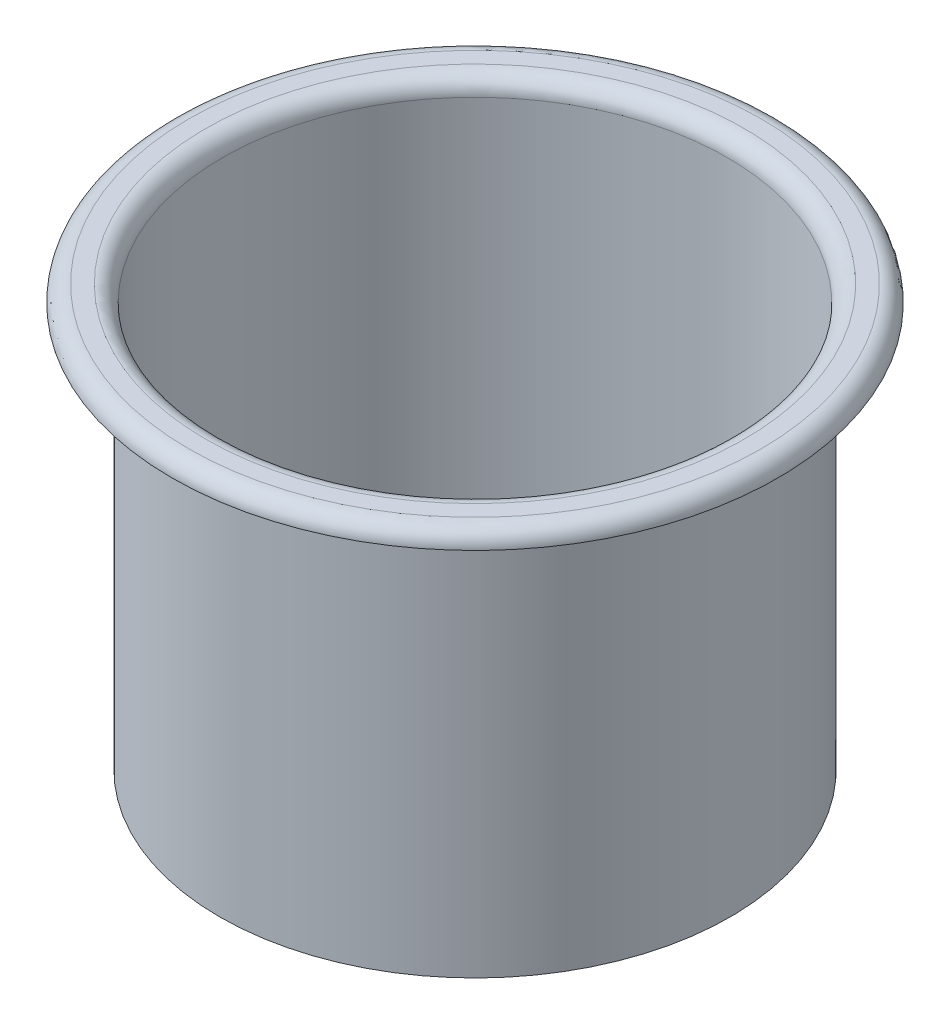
SolidWorks part; units mm, degrees
ref_plane "Front Plane" through (0, 0, 0) normal (0, 0, 1) x (1, 0, 0)
ref_plane "Top Plane" through (0, 0, 0) normal (0, 1, 0) x (1, 0, 0)
ref_plane "Right Plane" through (0, 0, 0) normal (1, 0, 0) x (0, 0, -1)
ref_plane "Plane1" through (0, 0, 0) normal (0, 0, -1) x (-1, 0, 0)
sketch "Sketch1" plane through (0, 0, 0) normal (0, 0, -1) x (-1, 0, 0)
  line L0 (-90, 0) -> (-89.1, 0)
  line L1 (-85, 4.1) -> (-80, 4.1)
  line L2 (-75.9, 0) -> (-75.9, -120)
  line L3 (-75.9, -120) -> (-75, -120)
  line L4 (-75, -120) -> (-75, 0)
  line L5 (-80, 5) -> (-85, 5)
  line L6 (0, -120) -> (0, 5.0023) construction
  arc A0 (-85, 5) -> (-90, 0) centre (-85, 0) ccw
  arc A1 (-89.1, 0) -> (-85, 4.1) centre (-85, 0) cw
  arc A2 (-80, 4.1) -> (-75.9, 0) centre (-80, 0) cw
  arc A3 (-75, 0) -> (-80, 5) centre (-80, 0) ccw
revolve "Revolve1" add sketch "Sketch1" angle 360 about L6
